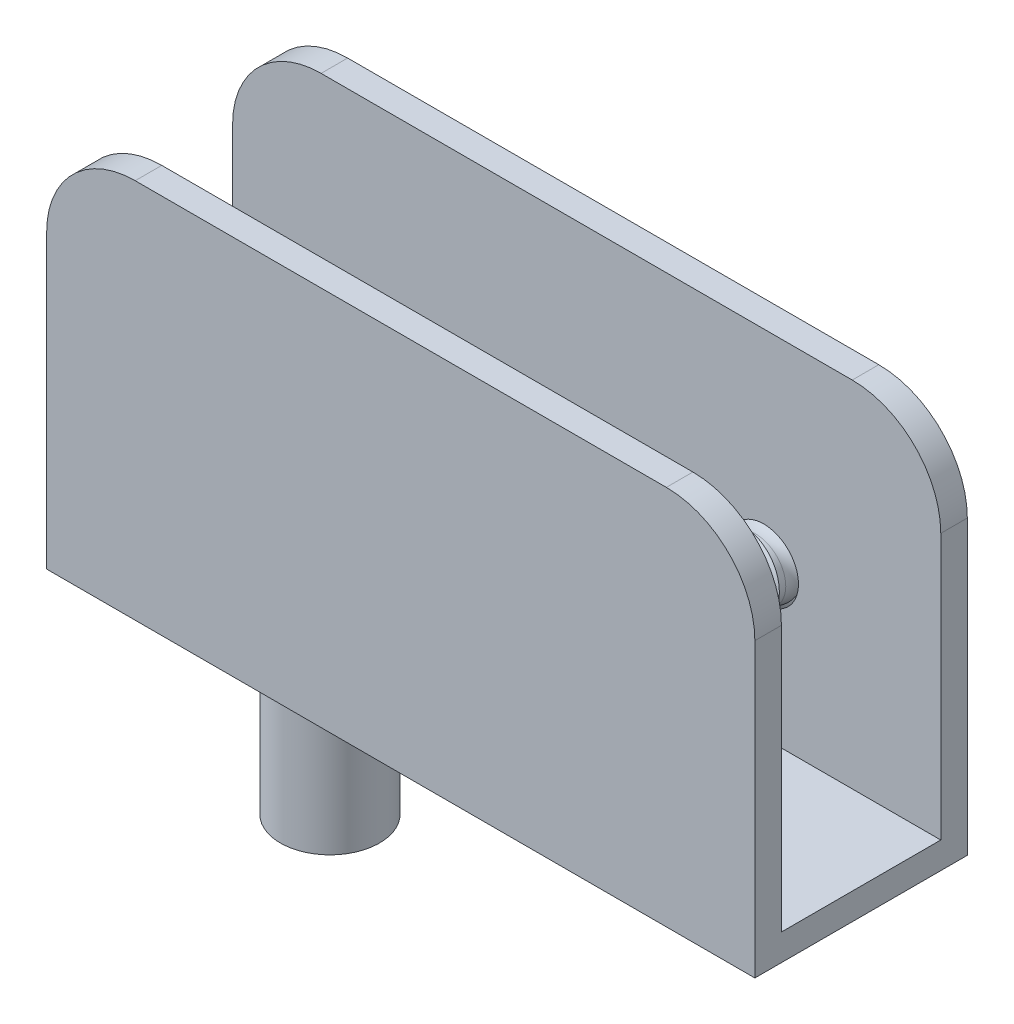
SolidWorks part; units mm, degrees
other "Hinge"
other "<Hinge Screw>-<Fillet4>"
other "<Hinge Screw>-<Fillet4>"
ref_plane "Front Plane" through (0, 0, 0) normal (0, 0, 1) x (1, 0, 0)
ref_plane "Top Plane" through (0, 0, 0) normal (0, 1, 0) x (1, 0, 0)
ref_plane "Right Plane" through (0, 0, 0) normal (1, 0, 0) x (0, 0, -1)
sketch "Sketch1" plane through (0, 0, 0) normal (1, 0, 0) x (0, 0, -1)
  line L1 (0, 0) -> (9, 0)
  line L2 (0, 0) -> (0, 20)
  line L4 (9, 0) -> (9, 20)
extrude "Extrude-Thin1" add sketch "Sketch1" along normal blind 40 thin
fillet "Fillet1" radius 5 4 edges at (0, 20, 0.75) (40, 20, 0.75) (0, 20, -9.75) (40, 20, -9.75)
sketch "Sketch2" plane through (0, -1.5, 0) normal (0, -1, 0) x (1, 0, 0)
  line L0 (0, -4.5) -> (10, -4.5) construction
  line L1 (0, -10.5) -> (0, 1.5) construction
  circle A0 centre (10, -4.5) radius 2.8
extrude "Boss-Extrude1" add sketch "Sketch2" along normal blind 10
sketch "Screw Guide" plane through (0, 0, -10.5) normal (0, 0, -1) x (-1, 0, 0)
  line L0 (0, -1.5) -> (0, 8.5) construction
  line L1 (0, 15) -> (0, -1.5) construction
  line L2 (0, 8.5) -> (-10, 8.5) construction
  line L3 (-10, 8.5) -> (-30, 8.5) construction
  point P7 (0, 0)
  point P8 (0, 0)
  point P9 (0, 0)
sketch "Screw Placement" plane through (0, 0, -10.5) normal (0, 0, -1) x (-1, 0, 0)
  circle A0 centre (-30, 8.5) radius 3.5
  circle A1 centre (-10, 8.5) radius 3.5
sketch "Sketch1-Hinge Screw" plane through (28.4535, -5.4897, -20.2512) normal (0, 1, 0) x (1, 0, 0)
  circle A0 centre (0, 0) radius 3.5
sketch "Sketch2-Hinge Screw" plane through (28.4535, -6.9897, -20.2512) normal (0, -1, 0) x (1, 0, 0)
  circle A2 centre (0, 0) radius 1.7124
sketch "Sketch3-Hinge Screw" plane through (28.4535, -6.69, -20.2512) normal (0, -1, 0) x (-1, 0, 0)
  circle A0 centre (0, 0) radius 2
sketch "Sketch5-Hinge Screw" plane through (28.4535, -5.4897, -20.2512) normal (0, 0, 1) x (1, 0, 0)
  line L6 (2.0696, -1.2003) -> (1.0229, -0.5959)
  line L7 (1.0229, -0.5959) -> (1.0229, -1.8046)
  line L8 (1.0229, -1.8046) -> (2.0696, -1.2003)
  circle A0 centre (1.3718, -1.2003) radius 0.3489 construction
sketch "Sketch6-Hinge Screw" plane through (28.4535, -11.4897, -20.2512) normal (0, -1, 0) x (-1, 0, 0)
  circle A2 centre (0, 0) radius 2
sketch "Sketch8-Hinge Screw" plane through (28.453, -5.4897, -20.2513) normal (-0.9511, -0.0001, -0.309) x (-0.309, 0, 0.9511)
  line L1 (-1.0227, -5.3965) -> (-1.0227, -6.6051)
  line L3 (-1.0227, -6.6051) -> (-2.0694, -6.0008)
  line L4 (-2.0694, -6.0008) -> (-1.0227, -5.3965)
sketch "Sketch9-Hinge Screw" plane through (28.4529, -5.4897, -20.2495) normal (-0.3087, -0.0002, 0.9512) x (0.9512, -0.0001, 0.3087)
  line L6 (-1.8941, -6.376) -> (-0.8474, -6.9803)
  line L7 (-0.8474, -6.9803) -> (-0.8474, -5.7716)
  line L8 (-0.8474, -5.7716) -> (-1.8941, -6.376)
sketch "Sketch10-Hinge Screw" plane through (28.4535, -5.4897, -20.2512) normal (0, 1, 0) x (1, 0, 0)
  line L0 (0.5, 0.5) -> (2, 0.5)
  line L1 (-0.5, -2) -> (0.5, -2)
  line L2 (-0.5, -2) -> (-0.5, -0.5)
  line L3 (-0.5, 2) -> (0.5, 2)
  line L4 (0.5, -2) -> (0.5, -0.5)
  line L5 (-2, -0.5) -> (-0.5, -0.5)
  line L6 (-2, -0.5) -> (-2, 0.5)
  line L7 (-2, 0.5) -> (-0.5, 0.5)
  line L8 (2, -0.5) -> (2, 0.5)
  line L9 (-0.5, 0.5) -> (-0.5, 2)
  line L10 (0.5, 0.5) -> (0.5, 2)
  line L11 (0.5, -0.5) -> (2, -0.5)
  point P0 (0, 0)
  point P5 (0, 0)
inserted part "Hinge Screw"
sketch "Sketch1-Hinge Screw1" plane through (5.5625, -6.4236, -15.951) normal (0, 1, 0) x (1, 0, 0)
  circle A0 centre (0, 0) radius 3.5
sketch "Sketch2-Hinge Screw1" plane through (5.5625, -7.9236, -15.951) normal (0, -1, 0) x (1, 0, 0)
  circle A2 centre (0, 0) radius 1.7124
sketch "Sketch3-Hinge Screw1" plane through (5.5625, -7.6239, -15.951) normal (0, -1, 0) x (-1, 0, 0)
  circle A0 centre (0, 0) radius 2
sketch "Sketch5-Hinge Screw1" plane through (5.5625, -6.4236, -15.951) normal (0, 0, 1) x (1, 0, 0)
  line L6 (2.0696, -1.2003) -> (1.0229, -0.5959)
  line L7 (1.0229, -0.5959) -> (1.0229, -1.8046)
  line L8 (1.0229, -1.8046) -> (2.0696, -1.2003)
  circle A0 centre (1.3718, -1.2003) radius 0.3489 construction
sketch "Sketch6-Hinge Screw1" plane through (5.5625, -12.4236, -15.951) normal (0, -1, 0) x (-1, 0, 0)
  circle A2 centre (0, 0) radius 2
sketch "Sketch8-Hinge Screw1" plane through (5.5621, -6.4236, -15.9512) normal (-0.9511, -0.0001, -0.309) x (-0.309, 0, 0.9511)
  line L1 (-1.0227, -5.3965) -> (-1.0227, -6.6051)
  line L3 (-1.0227, -6.6051) -> (-2.0694, -6.0008)
  line L4 (-2.0694, -6.0008) -> (-1.0227, -5.3965)
sketch "Sketch9-Hinge Screw1" plane through (5.562, -6.4236, -15.9494) normal (-0.3087, -0.0002, 0.9512) x (0.9512, -0.0001, 0.3087)
  line L6 (-1.8941, -6.376) -> (-0.8474, -6.9803)
  line L7 (-0.8474, -6.9803) -> (-0.8474, -5.7716)
  line L8 (-0.8474, -5.7716) -> (-1.8941, -6.376)
sketch "Sketch10-Hinge Screw1" plane through (5.5625, -6.4236, -15.951) normal (0, 1, 0) x (1, 0, 0)
  line L0 (0.5, 0.5) -> (2, 0.5)
  line L1 (-0.5, -2) -> (0.5, -2)
  line L2 (-0.5, -2) -> (-0.5, -0.5)
  line L3 (-0.5, 2) -> (0.5, 2)
  line L4 (0.5, -2) -> (0.5, -0.5)
  line L5 (-2, -0.5) -> (-0.5, -0.5)
  line L6 (-2, -0.5) -> (-2, 0.5)
  line L7 (-2, 0.5) -> (-0.5, 0.5)
  line L8 (2, -0.5) -> (2, 0.5)
  line L9 (-0.5, 0.5) -> (-0.5, 2)
  line L10 (0.5, 0.5) -> (0.5, 2)
  line L11 (0.5, -0.5) -> (2, -0.5)
  point P0 (0, 0)
  point P5 (0, 0)
inserted part "Hinge Screw1"
move or copy body "Body-Move/Copy1" bodies to move or copy 118 placed by mates yes
move or copy body "Body-Move/Copy2" bodies to move or copy 119 placed by mates yes
sketch "Sketch44" plane through (0, 0, -10.5) normal (0, 0, -1) x (-1, 0, 0)
  circle A0 centre (-30, 8.5) radius 3.75
  circle A1 centre (-10, 8.5) radius 3.5
extrude "Cut-Extrude5" cut sketch "Sketch44" against normal blind 1.5 draft 50
